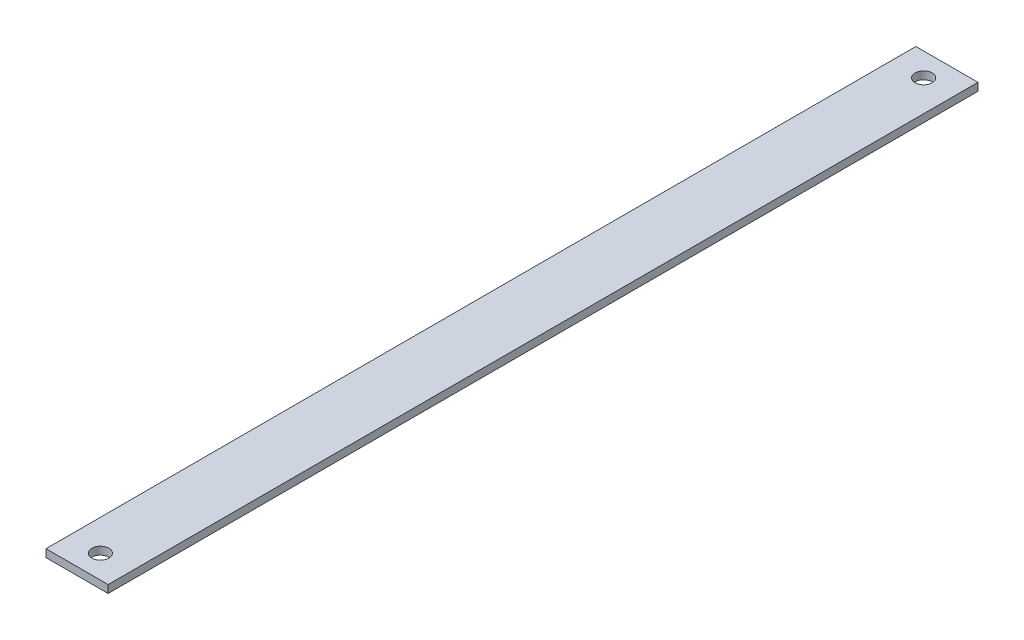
SolidWorks part; units mm, degrees
ref_plane "Face" through (0, 0, 0) normal (0, 0, 1) x (1, 0, 0)
ref_plane "Dessus" through (0, 0, 0) normal (0, 1, 0) x (1, 0, 0)
ref_plane "Droite" through (0, 0, 0) normal (1, 0, 0) x (0, 0, -1)
sketch "Esquisse1" plane through (0, 0, 0) normal (0, 0, 1) x (1, 0, 0)
  line L1 (0, 0) -> (40, 0)
  line L2 (0, 0) -> (0, 5)
  line L3 (0, 5) -> (40, 5)
  line L4 (40, 0) -> (40, 5)
  dimension "D1" = 40
  dimension "D2" = 5
extrude "Base-Extrusion" add sketch "Esquisse1" along normal blind 560
sketch "Esquisse2" plane through (0, 5, 0) normal (0, 1, 0) x (-1, 0, 0)
  line L0 (0, 560) -> (0, 0) construction
  line L1 (-40, 0) -> (0, 0) construction
  line L2 (0, 560) -> (-40, 560) construction
  line L3 (-40, 560) -> (0, 560) construction
  circle A0 centre (-20, 15) radius 5.5
  circle A1 centre (-20, 545) radius 5.5
  dimension "D1" = 11
  dimension "D2" = 20
  dimension "D3" = 15
  dimension "D4" = 15
extrude "Enlèv. mat.-Extru.1" cut sketch "Esquisse2" against normal through all
